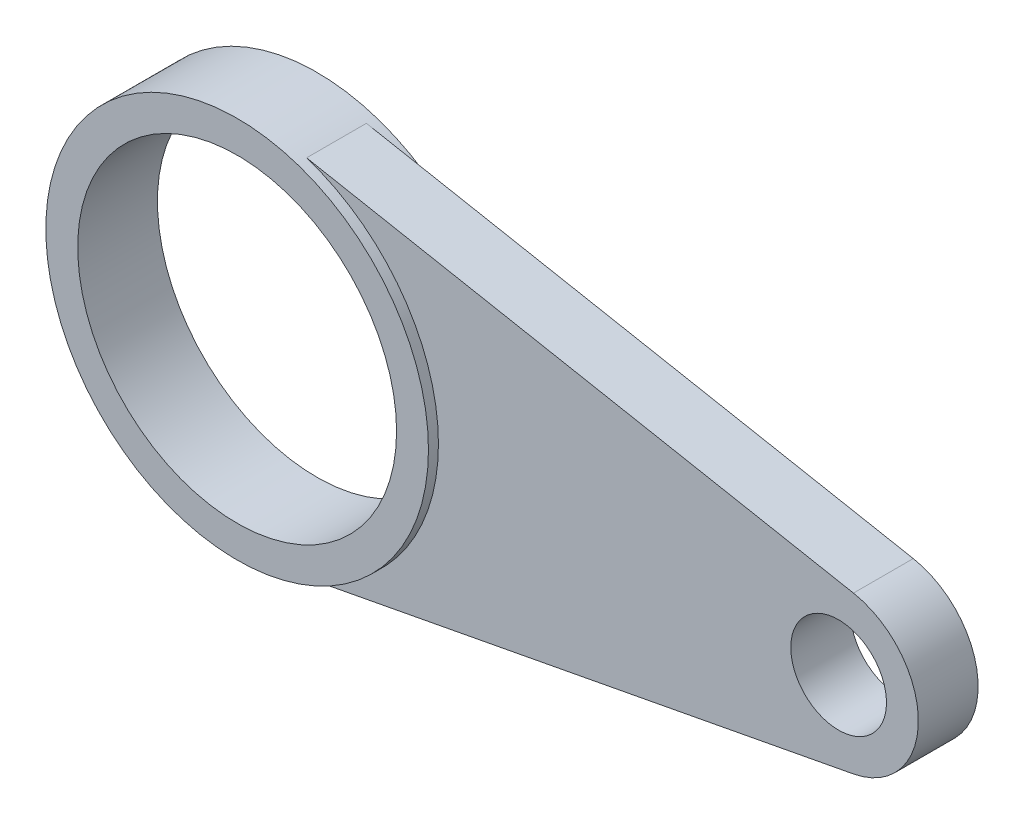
SolidWorks part; units mm, degrees
ref_plane "Front Plane" through (0, 0, 0) normal (0, 0, 1) x (1, 0, 0)
ref_plane "Top Plane" through (0, 0, 0) normal (0, 1, 0) x (1, 0, 0)
ref_plane "Right Plane" through (0, 0, 0) normal (1, 0, 0) x (0, 0, -1)
sketch "Sketch1" plane through (0, 0, 0) normal (0, 0, 1) x (1, 0, 0)
  circle A0 centre (0, 0) radius 30.48
  circle A1 centre (0, 0) radius 25.4
  dimension "D1" = 50.8
  dimension "D2" = 60.96
extrude "Boss-Extrude1" add sketch "Sketch1" along normal mid plane 12.7
sketch "Sketch2" plane through (0, 0, 0) normal (0, 0, 1) x (1, 0, 0)
  line L0 (-1000, 0) -> (49000, 0) construction
  line L1 (0, -1000) -> (0, 49000) construction
  line L2 (96.596, 12.4784) -> (5.6215, 29.6986)
  line L3 (96.596, -12.4784) -> (5.6215, -29.6986)
  arc A0 (96.596, -12.4784) -> (96.596, 12.4784) centre (94.234, 0) ccw
  circle A1 centre (94.234, 0) radius 7.62
  arc A2 (5.6215, -29.6986) -> (5.6215, 29.6986) centre (0, 0) ccw
  dimension "D1" = 25.4
  dimension "D3" = 15.24
  dimension "D4" = 60.452
  dimension "D2" = 94.234
extrude "Boss-Extrude2" add sketch "Sketch2" along normal mid plane 9.525
